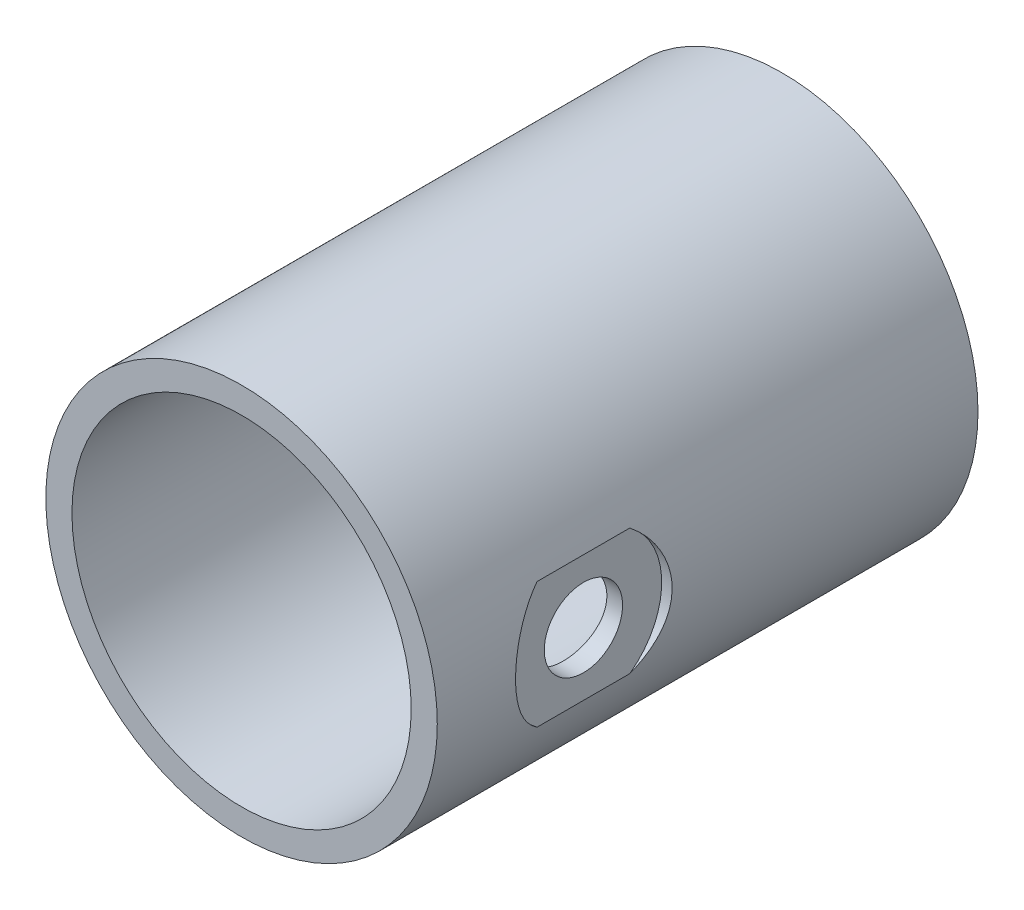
SolidWorks part; units mm, degrees
ref_plane "Plane1" through (0, 0, 0) normal (0, 0, 1) x (1, 0, 0)
ref_plane "Plane2" through (0, 0, 0) normal (0, 1, 0) x (1, 0, 0)
ref_plane "Plane3" through (0, 0, 0) normal (1, 0, 0) x (0, 0, -1)
sketch "Sketch1" plane through (0, 0, 0) normal (0, 0, 1) x (1, 0, 0)
  circle A0 centre (0, 0) radius 82.55
  circle A1 centre (0, 0) radius 95.25
  dimension "D1" = 165.1
  dimension "D2" = 190.5
extrude "Base-Extrude" add sketch "Sketch1" along normal blind 263.144
ref_plane "Plane4" through (95.25, 0, 131.572) normal (1, 0, 0) x (0, -1, 0)
sketch "Sketch3" plane through (95.25, 0, 131.572) normal (1, 0, 0) x (0, -1, 0)
  line L0 (0, 111.5988) -> (0, -144.9356) construction
  line L1 (0, -131.572) -> (0, 131.572) construction
  line L2 (-95.25, -131.572) -> (95.25, -131.572) construction
  circle A0 centre (0, -55.372) radius 38.1
  dimension "D1" = 76.2
  dimension "D2" = 76.2
extrude "Cut-Extrude1" cut sketch "Sketch3" against normal blind 5.08
sketch "Sketch4" plane through (90.17, 0, 0) normal (1, 0, 0) x (0, 0, -1)
  circle A0 centre (-186.944, 0) radius 19.05
  dimension "D1" = 38.1
extrude "Cut-Extrude2" cut sketch "Sketch4" against normal blind 25.4
